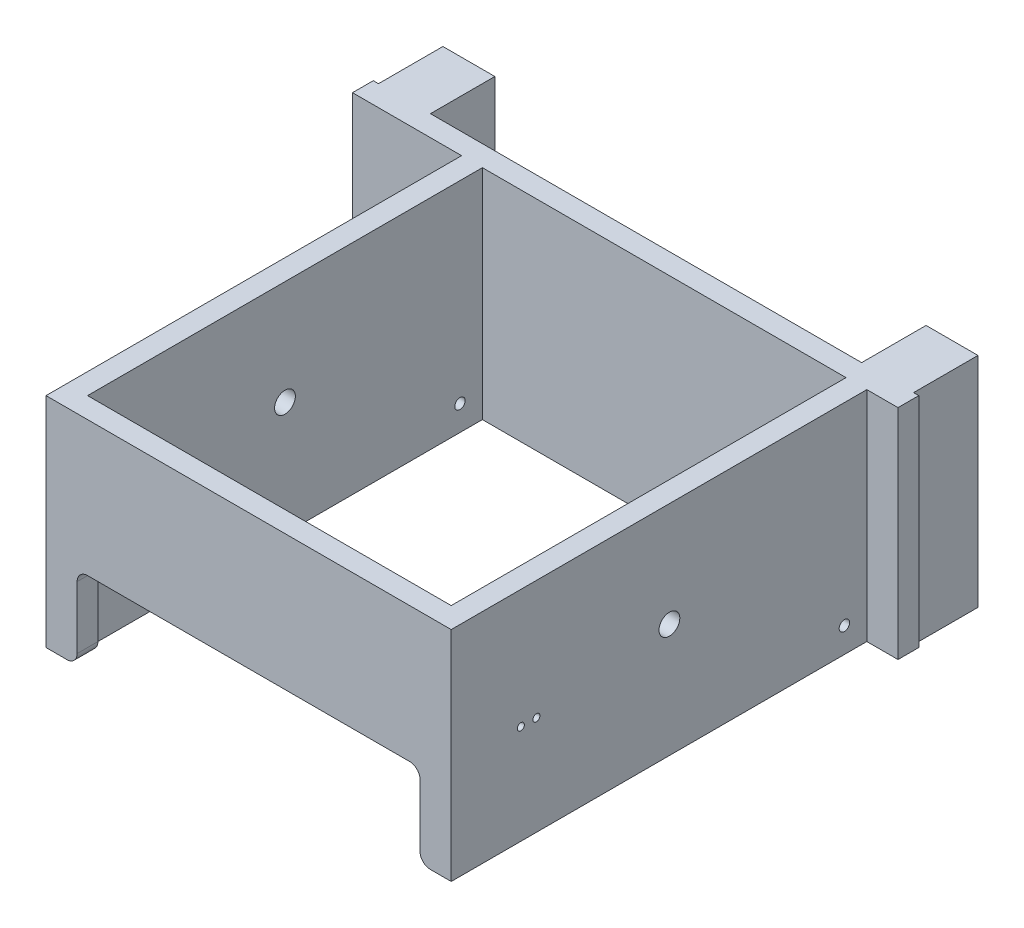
SolidWorks part; units mm, degrees
ref_plane "Plan de face" through (0, 0, 0) normal (0, 0, 1) x (1, 0, 0)
ref_plane "Plan de dessus" through (0, 0, 0) normal (0, 1, 0) x (1, 0, 0)
ref_plane "Plan de droite" through (0, 0, 0) normal (1, 0, 0) x (0, 0, -1)
sketch "Esquisse1" plane through (0, 0, 0) normal (0, 0, 1) x (1, 0, 0)
  line L1 (-64.775, 36.6791) -> (460.225, 36.6791)
  line L2 (-64.775, 36.6791) -> (-64.775, -173.3209)
  line L3 (-64.775, -173.3209) -> (460.225, -173.3209)
  line L4 (460.225, 36.6791) -> (460.225, -173.3209)
  dimension "D1" = 525
  dimension "D2" = 210
extrude "Boss.-Extru.1" add sketch "Esquisse1" along normal blind 20
sketch "Esquisse2" plane through (0, 0, 20) normal (0, 0, 1) x (1, 0, 0)
  line L1 (410.225, 36.6791) -> (430.225, 36.6791)
  line L2 (410.225, 36.6791) -> (410.225, -173.3209)
  line L3 (410.225, -173.3209) -> (430.225, -173.3209)
  line L4 (430.225, 36.6791) -> (430.225, -173.3209)
  line L5 (60.225, 36.6791) -> (40.225, 36.6791)
  line L6 (60.225, 36.6791) -> (60.225, -173.3209)
  line L7 (60.225, -173.3209) -> (40.225, -173.3209)
  line L8 (40.225, 36.6791) -> (40.225, -173.3209)
  line L9 (460.225, -173.3209) -> (460.225, 36.6791) construction
  dimension "D1" = 210
  dimension "D2" = 350
  dimension "D3" = 20
  dimension "D4" = 20
  dimension "D7" = 30
extrude "Boss.-Extru.2" add sketch "Esquisse2" along normal blind 400
sketch "Esquisse3" plane through (410.225, 0, 0) normal (-1, 0, 0) x (0, 0, 1)
  line L1 (420, 36.6791) -> (400, 36.6791)
  line L2 (420, 36.6791) -> (420, -173.3209)
  line L3 (420, -173.3209) -> (400, -173.3209)
  line L4 (400, 36.6791) -> (400, -173.3209)
  line L5 (420, 36.6791) -> (20, 36.6791) construction
  line L6 (420, -173.3209) -> (20, -173.3209) construction
  line L7 (420, 36.6791) -> (420, -173.3209) construction
  dimension "D1" = 0
  dimension "D2" = 0
  dimension "D3" = 0
  dimension "D4" = 20
extrude "Boss.-Extru.3" add sketch "Esquisse3" along normal blind 350
sketch "Esquisse4" plane through (430.225, 0, 0) normal (1, 0, 0) x (0, 0, -1)
  line L0 (-420, -173.3209) -> (-420, 36.6791) construction
  line L1 (-420, 36.6791) -> (-20, 36.6791) construction
  circle A0 centre (-210, -63.8209) radius 10
  circle A1 centre (-41.5967, -149.1582) radius 5
  dimension "D2" = 20
  dimension "D3" = 10
  dimension "D4" = 210
  dimension "D1" = 100.5
extrude "Enlèv. mat.-Extru.1" cut sketch "Esquisse4" against normal through all
sketch "Esquisse5" plane through (0, 0, 0) normal (0, 0, -1) x (-1, 0, 0)
  line L0 (64.775, -173.3209) -> (-460.225, -173.3209) construction
  line L1 (59.775, -173.3209) -> (9.775, -173.3209)
  line L2 (59.775, -173.3209) -> (59.775, 36.6791)
  line L3 (59.775, 36.6791) -> (9.775, 36.6791)
  line L4 (9.775, -173.3209) -> (9.775, 36.6791)
  line L5 (-460.225, 36.6791) -> (64.775, 36.6791) construction
  line L6 (-460.225, -173.3209) -> (-460.225, 36.6791) construction
  line L7 (-405.225, -173.3209) -> (-455.225, -173.3209)
  line L8 (-405.225, -173.3209) -> (-405.225, 36.6791)
  line L9 (-405.225, 36.6791) -> (-455.225, 36.6791)
  line L10 (-455.225, -173.3209) -> (-455.225, 36.6791)
  line L11 (64.775, 36.6791) -> (64.775, -173.3209) construction
  dimension "D1" = 5
  dimension "D2" = 50
  dimension "D3" = 5
  dimension "D4" = 50
extrude "Boss.-Extru.4" add sketch "Esquisse5" along normal blind 62
hole_wizard "Trou taraudé M81" positions "Esquisse7" profile "Esquisse6" tap size "M8" standard "Iso"
sketch "Esquisse7" plane through (40.225, 0, 0) normal (-1, 0, 0) x (0, 0, 1)
  point P0 (353, -77.8209)
  point P3 (338, -77.8209)
sketch "Esquisse6" plane through (40.225, -77.8209, 353) normal (0, 1, 0) x (0, 0, 1)
  line L0 (0, 0) -> (0, 420)
  line L1 (0, 420) -> (3.4, 420)
  line L2 (3.4, 420) -> (3.4, 0)
  line L5 (3.4, 0) -> (0, 0)
  line L11 (0, -6.35) -> (0, 107.95) construction
  dimension "Diamètre du trou pour taraudage jusqu'au prochain" = 6.8
  dimension "Profondeur du trou pour taraudage jusqu'au prochain" = 420
hole_wizard "Trou taraudé M101" positions "Esquisse9" profile "Esquisse8" tap size "M10" standard "ISO"
sketch "Esquisse9" plane through (0, 0, -62) normal (0, 0, -1) x (-1, 0, 0)
  line L0 (-405.225, 36.6791) -> (-455.225, 36.6791) construction
  line L1 (-455.225, 36.6791) -> (-455.225, -173.3209) construction
  point P0 (-433.225, -3.3209)
  dimension "D1" = 40
  dimension "D2" = 22
sketch "Esquisse8" plane through (433.225, -3.3209, -62) normal (1, 0, 0) x (0, 1, 0)
  line L0 (0, 0) -> (0, 37.0537)
  line L1 (0, 37.0537) -> (4.25, 34.5)
  line L2 (4.25, 34.5) -> (4.25, 0.775)
  line L3 (4.25, 0.775) -> (5.025, 0)
  line L5 (5.025, 0) -> (0, 0)
  line L6 (-4.25, 0.775) -> (-5.025, 0) construction
  line L10 (0, 37.0537) -> (-4.25, 34.5) construction
  line L11 (0, -6.35) -> (0, 107.95) construction
  dimension "Diamètre du trou pour taraudage" = 8.5
  dimension "Profondeur du trou pour taraudage" = 34.5
  dimension "Diamètre du fraisage entrant" = 10.05
  dimension "Angle du fraisage entrant" = 90
  dimension "Angle de pointe" = 118
pattern_linear "Répétition linéaire1" count 2 spacing 130 along (0, -1, 0) count 2 spacing 471 along (-1, 0, 0) of "Trou taraudé M101"
sketch "Esquisse10" plane through (0, 0, 420) normal (0, 0, 1) x (1, 0, 0)
  line L1 (400.225, -173.3209) -> (70.225, -173.3209)
  line L2 (400.225, -173.3209) -> (400.225, -93.3209)
  line L3 (400.225, -93.3209) -> (70.225, -93.3209)
  line L4 (70.225, -173.3209) -> (70.225, -93.3209)
  line L5 (430.225, -173.3209) -> (430.225, 36.6791) construction
  line L6 (40.225, 36.6791) -> (40.225, -173.3209) construction
  line L7 (40.225, -173.3209) -> (430.225, -173.3209) construction
  dimension "D1" = 30
  dimension "D2" = 30
  dimension "D3" = 80
extrude "Enlèv. mat.-Extru.2" cut sketch "Esquisse10" against normal blind 30
fillet "Congé1" radius 10 4 edges at (70.225, -93.3209, 410) (70.225, -173.3209, 410) (400.225, -93.3209, 410) (400.225, -173.3209, 410)
